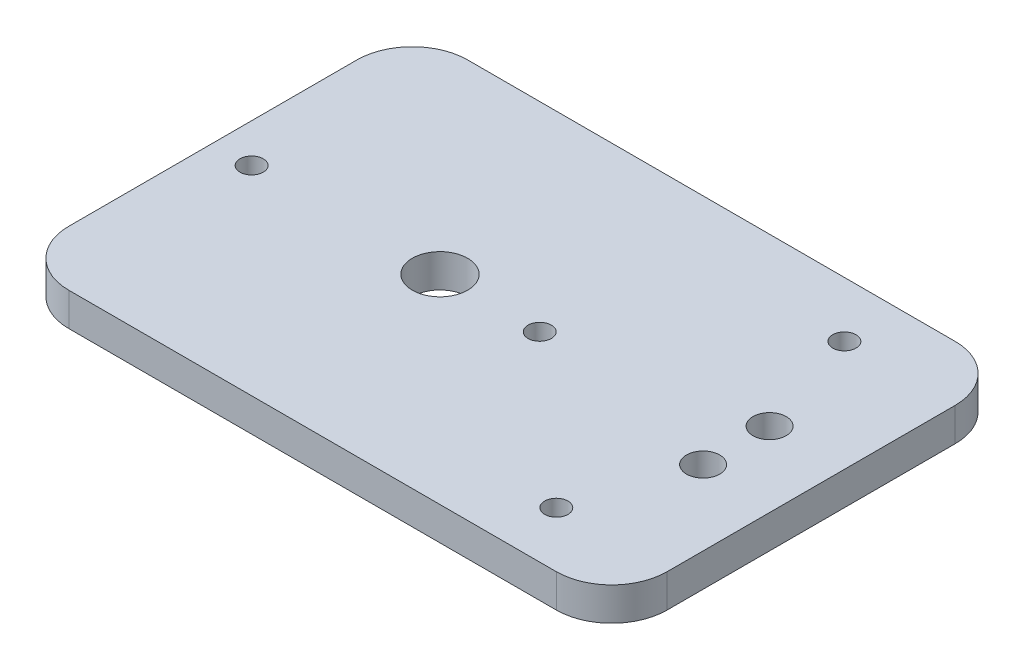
SolidWorks part; units mm, degrees
ref_plane "Front Plane" through (0, 0, 0) normal (0, 0, 1) x (1, 0, 0)
ref_plane "Top Plane" through (0, 0, 0) normal (0, 1, 0) x (1, 0, 0)
ref_plane "Right Plane" through (0, 0, 0) normal (1, 0, 0) x (0, 0, -1)
sketch "Sketch1" plane through (0, 0, 0) normal (0, 1, 0) x (1, 0, 0)
  line L0 (0, 36) -> (108, 36) construction
  line L1 (10, 0) -> (98, 0)
  line L2 (0, 10) -> (0, 62)
  line L3 (10, 72) -> (98, 72)
  line L4 (108, 10) -> (108, 62)
  circle A0 centre (41, 36) radius 5
  circle A1 centre (94.4965, 42) radius 3
  circle A2 centre (94.4965, 30) radius 3
  circle A3 centre (59, 36) radius 36 construction
  arc A4 (10, 72) -> (0, 62) centre (10, 62) ccw
  arc A5 (108, 62) -> (98, 72) centre (98, 62) ccw
  arc A6 (98, 0) -> (108, 10) centre (98, 10) ccw
  arc A7 (0, 10) -> (10, 0) centre (10, 10) ccw
  point P23 (0, 0)
  dimension "D1" = 10
  dimension "D2" = 6
  dimension "D3" = 6
  dimension "D5" = 6
  dimension "D8" = 41
  dimension "D9" = 72
  dimension "D7" = 67
  dimension "D10" = 18
  dimension "D11" = 10
  dimension "D4" = 6
  dimension "D6" = 36
extrude "Extrude1" add sketch "Sketch1" along normal blind 6
sketch "Sketch2" plane through (0, 6, 0) normal (0, 1, 0) x (1, 0, 0)
  line L0 (0, 62) -> (0, 10) construction
  line L1 (98, 72) -> (10, 72) construction
  line L2 (108, 10) -> (108, 62) construction
  line L3 (10, 0) -> (98, 0) construction
  circle A0 centre (41, 36) radius 5 construction
  point P0 (88, 62)
  point P1 (88, 10)
  point P2 (59, 36)
  point P3 (7, 36)
  point P4 (0, 36)
  dimension "D1" = 7
  dimension "D2" = 36
  dimension "D3" = 36
  dimension "D4" = 18
  dimension "D5" = 10
  dimension "D6" = 20
  dimension "D7" = 20
  dimension "D8" = 10
hole_wizard "M5 Tapped Hole1" positions "3DSketch1" profile "Sketch4" tap size "M5" standard "ISO"
sketch3d "3DSketch1"
  point P0 (7, 6, -36)
  point P3 (59, 6, -36)
  point P6 (88, 6, -62)
  point P9 (88, 6, -10)
sketch "Sketch4" plane through (7, 6, -36) normal (1, 0, 0) x (0, 0, 1)
  line L0 (0, 0) -> (0, 6)
  line L1 (0, 6) -> (2.1, 6)
  line L2 (2.1, 6) -> (2.1, 0)
  line L5 (2.1, 0) -> (0, 0)
  line L11 (0, -6.35) -> (0, 107.95) construction
  dimension "Thru Tap Drill Dia." = 4.2
  dimension "Thru Tap Drill Depth" = 6
